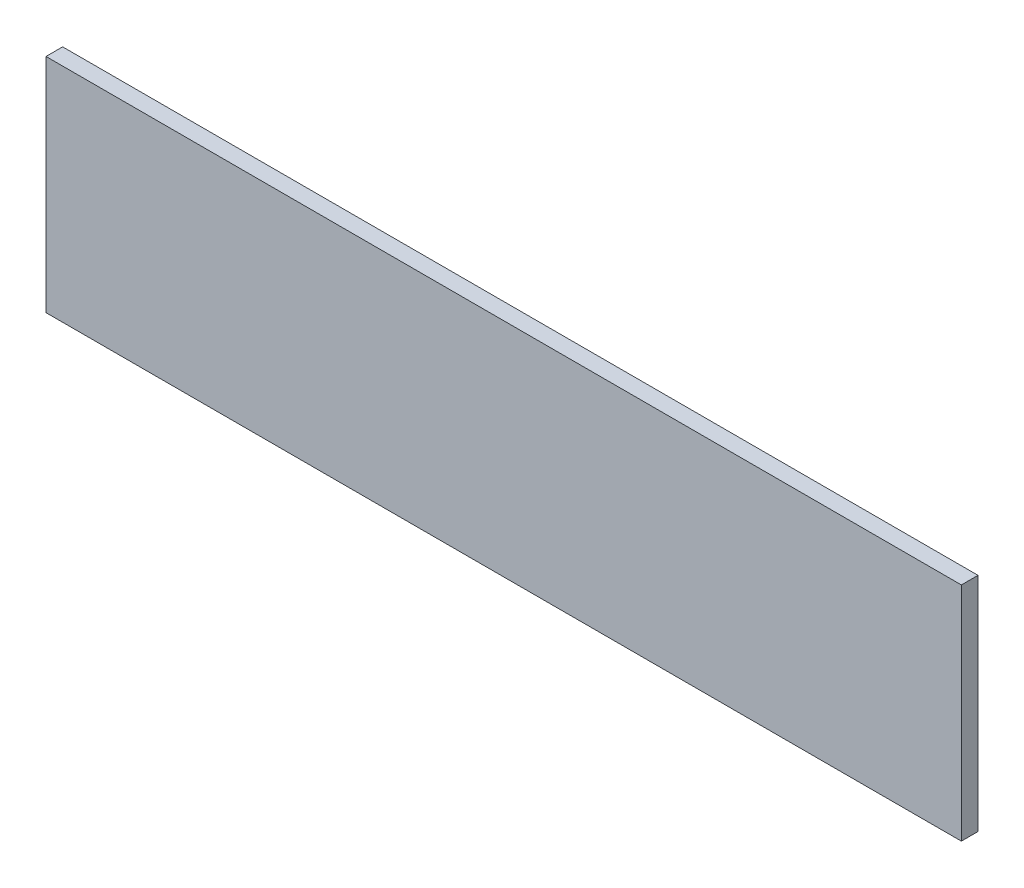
SolidWorks part; units mm, degrees
ref_plane "前视基准面" through (0, 0, 0) normal (0, 0, 1) x (1, 0, 0)
ref_plane "上视基准面" through (0, 0, 0) normal (0, 1, 0) x (1, 0, 0)
ref_plane "右视基准面" through (0, 0, 0) normal (1, 0, 0) x (0, 0, -1)
sketch "草图1" plane through (0, 0, 0) normal (0, 0, 1) x (1, 0, 0)
  line L1 (-82.5, -20) -> (82.5, -20)
  line L2 (-82.5, -20) -> (-82.5, 20)
  line L3 (-82.5, 20) -> (82.5, 20)
  line L4 (82.5, -20) -> (82.5, 20)
  line L5 (-82.5, -20) -> (82.5, 20) construction
  line L6 (-82.5, 20) -> (82.5, -20) construction
  point P0 (0, 0)
  dimension "D1" = 165
  dimension "D2" = 40
extrude "凸台-拉伸1" add sketch "草图1" along normal blind 3
